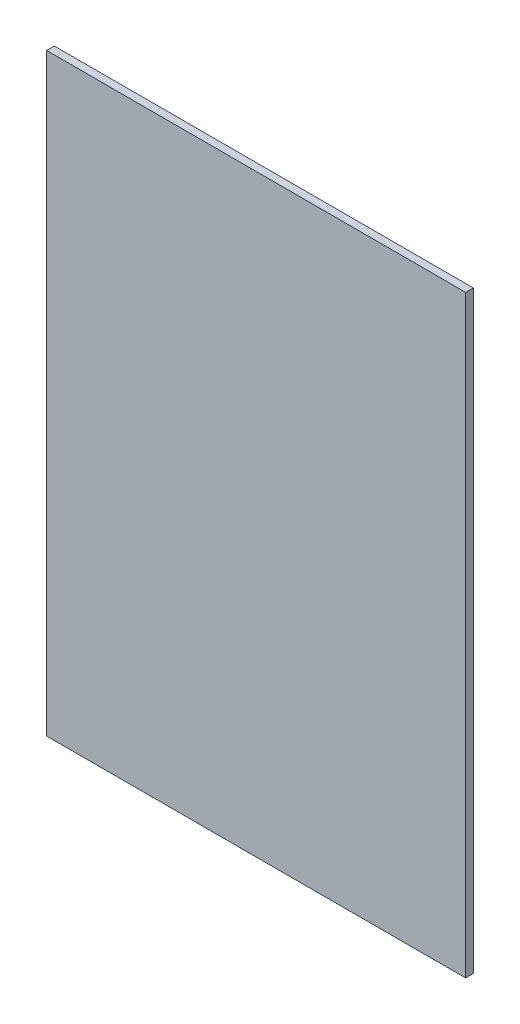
SolidWorks part; units mm, degrees
ref_plane "Front Plane" through (0, 0, 0) normal (0, 0, 1) x (1, 0, 0)
ref_plane "Top Plane" through (0, 0, 0) normal (0, 1, 0) x (1, 0, 0)
ref_plane "Right Plane" through (0, 0, 0) normal (1, 0, 0) x (0, 0, -1)
sketch "Sketch1" plane through (0, 0, 0) normal (0, 0, 1) x (1, 0, 0)
  line L1 (-76.2, 107.95) -> (76.2, 107.95)
  line L2 (-76.2, 107.95) -> (-76.2, -107.95)
  line L3 (-76.2, -107.95) -> (76.2, -107.95)
  line L4 (76.2, 107.95) -> (76.2, -107.95)
  line L5 (-76.2, 107.95) -> (76.2, -107.95) construction
  line L6 (-76.2, -107.95) -> (76.2, 107.95) construction
  point P0 (0, 0)
  dimension "D1" = 152.4
  dimension "D2" = 215.9
extrude "Boss-Extrude1" add sketch "Sketch1" along normal blind 2.794
equation "\"thickness_acrylic0.1\"=0.1in"
equation "\"motor offset\"=6mm"
equation "\"thickness0.25\"=0.225in"
equation "\"thickness0.125\"=0.122in"
